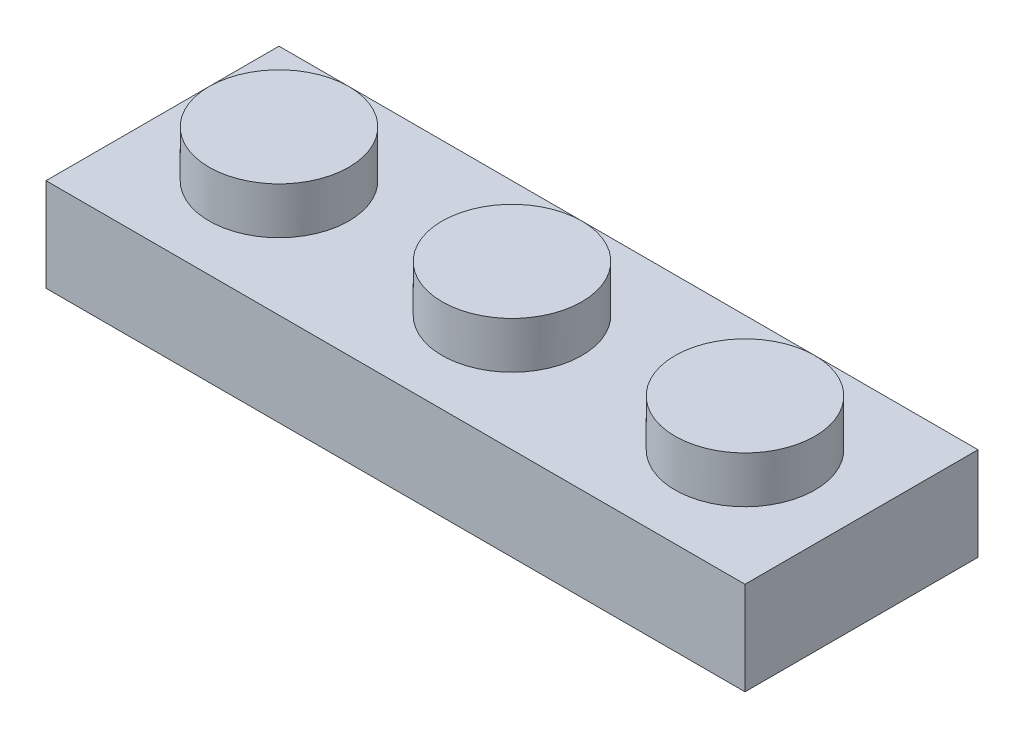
SolidWorks part; units mm, degrees
ref_plane "Front Plane" through (0, 0, 0) normal (0, 0, 1) x (1, 0, 0)
ref_plane "Top Plane" through (0, 0, 0) normal (0, 1, 0) x (1, 0, 0)
ref_plane "Right Plane" through (0, 0, 0) normal (1, 0, 0) x (0, 0, -1)
sketch "Sketch1" plane through (0, 0, 0) normal (0, 1, 0) x (1, 0, 0)
  line L5 (-24, -4) -> (24, -4)
  line L6 (-24, -4) -> (-24, 4)
  line L7 (-24, 4) -> (24, 4)
  line L8 (24, -4) -> (24, 4)
  line L9 (-24, -4) -> (24, 4) construction
  line L10 (-24, 4) -> (24, -4) construction
  point P0 (0, 0)
  dimension "D1" = 8
  dimension "D2" = 48
extrude "Boss-Extrude1" add sketch "Sketch1" along normal blind 3.2
sketch "Sketch2" plane through (0, 3.2, 0) normal (0, 1, 0) x (1, 0, 0)
  line L0 (-24, 4) -> (-24, -4) construction
  line L1 (-20, 0) -> (-12, 0) construction
  circle A2 centre (-20, 0) radius 2.4
  circle A6 centre (-12, 0) radius 2.4
  circle A7 centre (-4, 0) radius 2.4
  circle A8 centre (4, 0) radius 2.4
  circle A9 centre (12, 0) radius 2.4
  circle A10 centre (20, 0) radius 2.4
  dimension "D1" = 4.8
  dimension "D2" = 4
  dimension "D3" = 8
extrude "Boss-Extrude2" add sketch "Sketch2" along normal blind 1.6
shell "Shell1" thickness 1.6
sketch "Sketch3" plane through (0, 1.6, 0) normal (0, -1, 0) x (1, 0, 0)
  line L0 (0, 0) -> (-8, 0) construction
  circle A1 centre (0, 0) radius 1.7696
  circle A2 centre (8, 0) radius 1.7696
  circle A3 centre (16, 0) radius 1.7696
  circle A4 centre (-8, 0) radius 1.7696
  circle A5 centre (-16, 0) radius 1.7696
  dimension "D1" = 3
  dimension "D3" = 8
  dimension "D2" = 3
extrude "Boss-Extrude3" add sketch "Sketch3" along normal up to surface (1.6 mm away)
sketch "Sketch4" plane through (0, 0, 0) normal (1, 0, 0) x (0, 0, -1)
  line L0 (2.4, 4.8) -> (-2.4, 4.8) construction
  line L1 (-4, 0) -> (4, 0)
  line L2 (-4, 0) -> (-4, 4.8663)
  line L3 (-4, 4.8663) -> (4, 4.8663)
  line L4 (4, 0) -> (4, 4.8663)
  point P7 (0, 0)
  dimension "D1" = 0.0663
extrude "Cut-Extrude1" cut sketch "Sketch4" along normal through all
sketch "Sketch5" plane through (0, 0, 0) normal (1, 0, 0) x (0, 0, -1)
  line L0 (4, 0) -> (4, 3.2) construction
  line L1 (4, 2.05) -> (-4, 2.05)
  line L2 (4, 2.05) -> (4, 0)
  line L3 (4, 0) -> (-4, 0)
  line L4 (-4, 2.05) -> (-4, 0)
  line L5 (-4, 3.2) -> (4, 3.2) construction
  dimension "D1" = 1.15
extrude "Boss-Extrude4" add sketch "Sketch5" against normal blind 1.6
sketch "Sketch6" plane through (-1.6, 0, 0) normal (-1, 0, 0) x (0, 0, 1)
  line L1 (-2.4, 0) -> (2.4, 0)
  line L2 (-2.4, 0) -> (-2.4, 1.6)
  line L3 (-2.4, 1.6) -> (2.4, 1.6)
  line L4 (2.4, 0) -> (2.4, 1.6)
extrude "Cut-Extrude2" cut sketch "Sketch6" along normal blind 1.6
